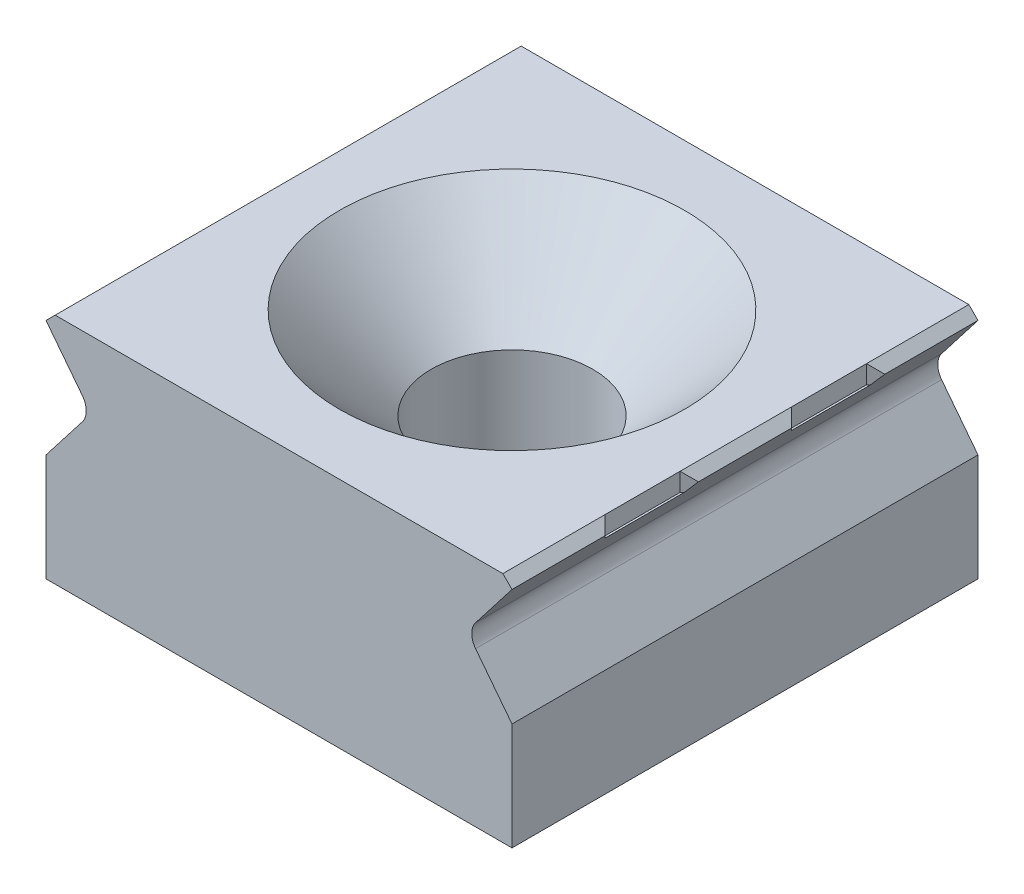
SolidWorks part; units mm, degrees
ref_plane "Front Plane" through (0, 0, 0) normal (0, 0, 1) x (1, 0, 0)
ref_plane "Top Plane" through (0, 0, 0) normal (0, 1, 0) x (1, 0, 0)
ref_plane "Right Plane" through (0, 0, 0) normal (1, 0, 0) x (0, 0, -1)
sketch "Sketch1" plane through (0, 0, 0) normal (0, 1, 0) x (1, 0, 0)
  line L1 (12.7, -12.7) -> (-12.7, -12.7)
  line L2 (12.7, -12.7) -> (12.7, 12.7)
  line L3 (12.7, 12.7) -> (-12.7, 12.7)
  line L4 (-12.7, -12.7) -> (-12.7, 12.7)
  line L5 (12.7, -12.7) -> (-12.7, 12.7) construction
  line L6 (12.7, 12.7) -> (-12.7, -12.7) construction
  point P0 (0, 0)
  dimension "D1" = 25.4
  dimension "D2" = 25.4
extrude "Boss-Extrude1" add sketch "Sketch1" along normal mid plane 12.7
chamfer "Chamfer1" distance 0.5 angle 45 2 edges at (12.7, 6.35, 0) (-12.7, 6.35, 0)
sketch "Sketch2" plane through (0, 0, 12.7) normal (0, 0, 1) x (1, 0, 0)
  line L0 (-12.7, 5.85) -> (-12.7, -0.5)
  line L1 (-12.7, 5.85) -> (-12.7, -6.35) construction
  line L2 (-12.7, 5.85) -> (-10.7145, 3.2875)
  line L3 (-10.7145, 2.0625) -> (-12.7, -0.5)
  arc A0 (-10.7145, 3.2875) -> (-10.7145, 2.0625) centre (-11.505, 2.675) cw
  point P8 (-10.24, 2.675)
  dimension "D4" = 1
  dimension "D1" = 6.35
  dimension "D2" = 3.175
  dimension "D3" = 2.46
extrude "Cut-Extrude1" cut sketch "Sketch2" against normal up to surface (25.4 mm away)
mirror "Mirror1" about plane through (0, 0, 0) normal (1, 0, 0) of "Cut-Extrude1"
sketch "Sketch3" plane through (0, 6.35, 0) normal (0, 1, 0) x (1, 0, 0)
  line L0 (-12.7, -7.62) -> (-12.7, -2.54)
  line L1 (-12.7, -12.7) -> (-12.7, 12.7) construction
  line L2 (-12.7, -2.54) -> (-12.2, -3.04)
  line L3 (-12.2, 12.7) -> (-12.2, -12.7) construction
  line L4 (-12.2, -3.04) -> (-12.2, -7.12)
  line L5 (-12.2, -7.12) -> (-12.7, -7.62)
  line L6 (-12.2, -12.7) -> (-12.7, -12.7) construction
  line L7 (12.7, -7.62) -> (12.2, -7.12)
  line L8 (12.7, 12.7) -> (12.7, -12.7) construction
  line L9 (12.2, -12.7) -> (12.2, 12.7) construction
  line L10 (12.2, -7.12) -> (12.2, -3.04)
  line L11 (12.2, -3.04) -> (12.7, -2.54)
  line L12 (12.7, -2.54) -> (12.7, -7.62)
  line L13 (-12.2, -12.7) -> (12.2, -12.7) construction
  dimension "D1" = 5.08
  dimension "D2" = 90
  dimension "D3" = 5.08
  dimension "D4" = 5.08
extrude "Cut-Extrude2" cut sketch "Sketch3" against normal blind 1
pattern_linear "LPattern1" count 2 spacing 10.16 along (0, 0, -1) of "Cut-Extrude2"
sketch "Sketch4" plane through (0, 6.35, 0) normal (0, 1, 0) x (1, 0, 0)
  circle A0 centre (0, 0) radius 4.4
  dimension "D1" = 8.8
extrude "Cut-Extrude3" cut sketch "Sketch4" against normal up to surface (12.7 mm away)
chamfer "Chamfer2" distance 5 angle 45 1 edges at (0, 6.35, 4.4)
